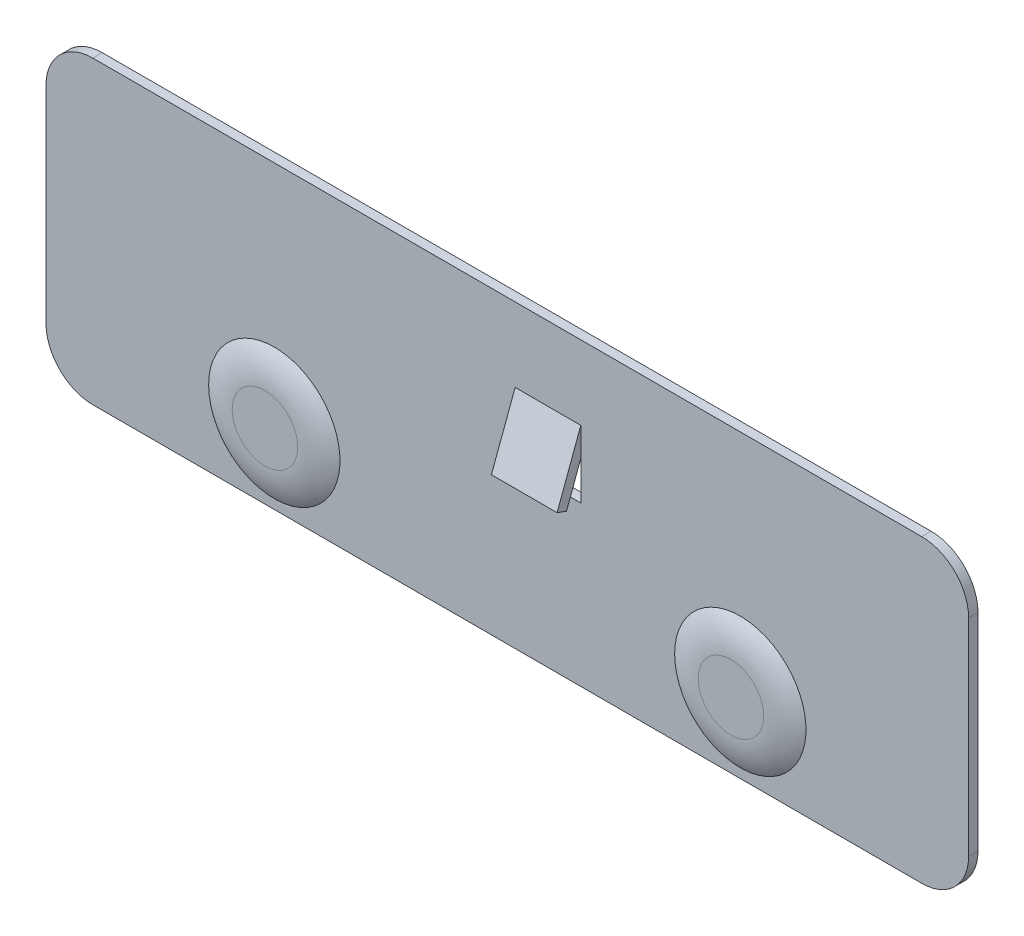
SolidWorks part; units mm, degrees
ref_plane "Plan de face" through (0, 0, 0) normal (0, 0, 1) x (1, 0, 0)
ref_plane "Plan de dessus" through (0, 0, 0) normal (0, 1, 0) x (1, 0, 0)
ref_plane "Plan de droite" through (0, 0, 0) normal (1, 0, 0) x (0, 0, -1)
sketch "Esquisse1" plane through (0, 0, 0) normal (0, 0, 1) x (1, 0, 0)
  line L1 (1.5, 0) -> (28, 0)
  line L2 (0, 1.5) -> (0, 8.1)
  line L3 (1.5, 9.6) -> (28, 9.6)
  line L4 (29.5, 1.5) -> (29.5, 8.1)
  arc A0 (0, 8.1) -> (1.5, 9.6) centre (1.5, 8.1) cw
  arc A1 (28, 9.6) -> (29.5, 8.1) centre (28, 8.1) cw
  arc A2 (28, 0) -> (29.5, 1.5) centre (28, 1.5) ccw
  arc A3 (1.5, 0) -> (0, 1.5) centre (1.5, 1.5) cw
  point P13 (0, 0)
  dimension "D1" = 1.5
  dimension "D2" = 29.5
  dimension "D3" = 9.6
extrude "Extrusion1" add sketch "Esquisse1" along normal blind 0.3
sketch "Esquisse2" plane through (0, 0, 0) normal (0, 0, 1) x (1, 0, 0)
  line L0 (1.5, 0) -> (28, 0) construction
  line L1 (0, 8.1) -> (0, 1.5) construction
  line L2 (29.5, 1.5) -> (29.5, 8.1) construction
  circle A0 centre (7.3, 2.4) radius 2.1
  circle A1 centre (22.2, 2.4) radius 2.1
  dimension "D1" = 4.2
  dimension "D2" = 4.2
  dimension "D3" = 2.4
  dimension "D4" = 2.4
  dimension "D5" = 7.3
  dimension "D6" = 7.3
extrude "Extrusion2" add sketch "Esquisse2" along normal blind 0.6
fillet "Congé1" radius 2 2 edges at (24.3, 2.4, 0.6) (9.4, 2.4, 0.6)
sketch "Esquisse3" plane through (0, 0, 0) normal (0, 0, 1) x (1, 0, 0)
  circle A0 centre (7.3, 2.4) radius 1.25
  circle A1 centre (22.2, 2.4) radius 1.25
  dimension "D1" = 2.5
  dimension "D2" = 2.5
extrude "Enlèv. mat.-Extru.2" cut sketch "Esquisse3" along normal blind 0.3
fillet "Congé2" radius 0.5 2 edges at (23.45, 2.4, 0) (8.55, 2.4, 0)
sketch "Esquisse4" plane through (0, 0, 0) normal (0, 0, 1) x (1, 0, 0)
  line L0 (29.5, 1.5) -> (29.5, 8.1) construction
  line L1 (15, 7.2314) -> (17.1, 7.2314)
  line L2 (15, 7.2314) -> (15, 5.0814)
  line L3 (15, 5.0814) -> (17.1, 5.0814)
  line L4 (17.1, 7.2314) -> (17.1, 5.0814)
  dimension "D1" = 2.1
  dimension "D2" = 2.15
  dimension "D3" = 14.5
extrude "Extrusion3" add sketch "Esquisse4" along normal blind 1.1
sketch "Esquisse5" plane through (15, 0, 0) normal (-1, 0, 0) x (0, 0, 1)
  line L0 (0.3, 7.2314) -> (1.1, 7.2314)
  line L1 (1.1, 7.2314) -> (1.1, 5.0814)
  line L3 (0, 7.1198) -> (0, 5.0814)
  line L5 (0, 7.1198) -> (0.7585, 5.0814)
  line L7 (0, 5.0814) -> (0.7585, 5.0814)
  line L8 (0.3, 7.2314) -> (1.1, 5.0814)
extrude "Enlèv. mat.-Extru.4" cut sketch "Esquisse5" against normal blind 2.1
sketch "Esquisse6" plane through (15, 0, 0) normal (-1, 0, 0) x (0, 0, 1)
  line L0 (0.7585, 5.0814) -> (1.0585, 5.193)
  line L1 (0.3, 7.2314) -> (1.1, 5.0814) construction
  line L2 (1.0585, 5.193) -> (1.1, 5.0814)
  line L3 (1.1, 5.0814) -> (0.7585, 5.0814)
extrude "Enlèv. mat.-Extru.5" cut sketch "Esquisse6" against normal through all
